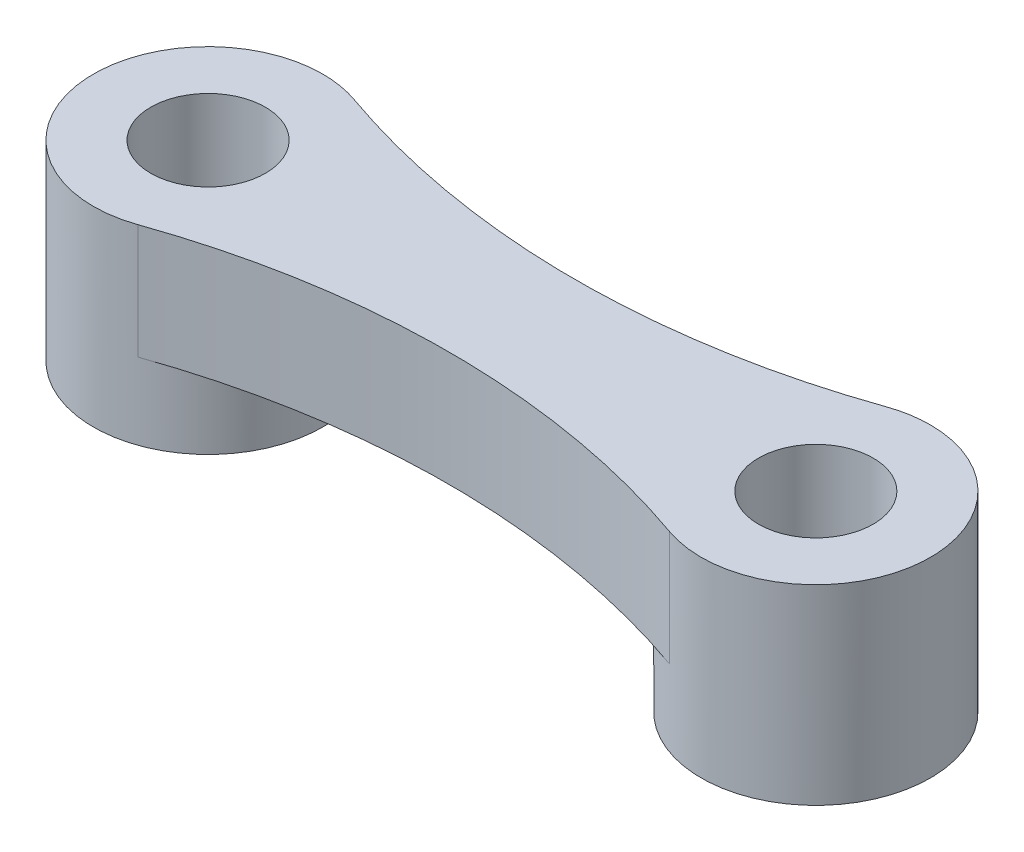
SolidWorks part; units mm, degrees
ref_plane "前视基准面" through (0, 0, 0) normal (0, 0, 1) x (1, 0, 0)
ref_plane "上视基准面" through (0, 0, 0) normal (0, 1, 0) x (1, 0, 0)
ref_plane "右视基准面" through (0, 0, 0) normal (1, 0, 0) x (0, 0, -1)
ref_plane "基准面1" through (0, 0, 0) normal (0, -1, 0) x (1, 0, 0)
sketch "草图1" plane through (0, 0, 0) normal (0, -1, 0) x (1, 0, 0)
  arc A0 (-6.9562, -2.8306) -> (6.9562, -2.8306) centre (0, -22.645) cw
  arc A1 (6.9562, -2.8306) -> (6.9562, 2.8306) centre (7.95, 0) ccw
  arc A2 (6.9562, 2.8306) -> (-6.9562, 2.8306) centre (0, 22.645) cw
  arc A3 (-6.9562, 2.8306) -> (-6.9562, -2.8306) centre (-7.95, 0) ccw
extrude "凸台-拉伸1" add sketch "草图1" against normal blind 3
sketch "草图2" plane through (0, 0, 0) normal (0, -1, 0) x (1, 0, 0)
  circle A0 centre (7.95, 0) radius 3
extrude "凸台-拉伸2" add sketch "草图2" along normal blind 2
sketch "草图3" plane through (0, 0, 0) normal (0, -1, 0) x (1, 0, 0)
  circle A0 centre (-7.95, 0) radius 3
extrude "凸台-拉伸3" add sketch "草图3" along normal blind 2
hole_wizard "Ø3.0 (3) Diameter Hole1" positions "Sketch5" profile "Sketch4" hole size "Ø3.0" standard "ANSI Metric"
sketch "Sketch5" plane through (0, 3, 0) normal (0, 1, 0) x (1, 0, 0)
  point P0 (-7.95, 0)
  point P1 (7.95, 0)
sketch "Sketch4" plane through (-7.95, 3, 0) normal (1, 0, 0) x (0, 0, 1)
  line L0 (0, 0) -> (0, 5)
  line L1 (0, 5) -> (1.5, 5)
  line L2 (1.5, 5) -> (1.5, 0)
  line L5 (1.5, 0) -> (0, 0)
  line L11 (0, -6.35) -> (0, 107.95) construction
  dimension "Thru Hole Dia." = 3
  dimension "Thru Hole Depth" = 5
